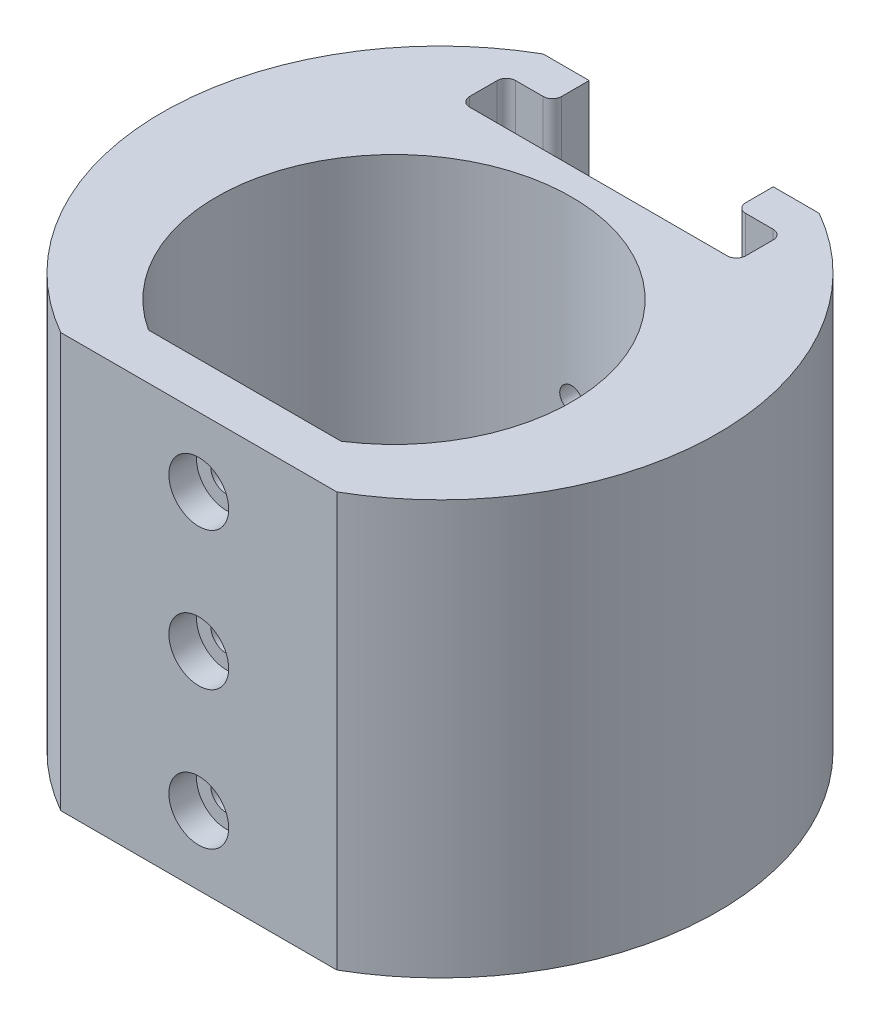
SolidWorks part; units mm, degrees
ref_plane "Front Plane" through (0, 0, 0) normal (0, 0, 1) x (1, 0, 0)
ref_plane "Top Plane" through (0, 0, 0) normal (0, 1, 0) x (1, 0, 0)
ref_plane "Right Plane" through (0, 0, 0) normal (1, 0, 0) x (0, 0, -1)
sketch "Sketch1" plane through (0, 0, 0) normal (0, 1, 0) x (1, 0, 0)
  line L0 (-10, -16.2143) -> (10, -16.2143)
  line L1 (-15, -21.2143) -> (15, -21.2143)
  line L2 (-15, 31.2143) -> (15, 31.2143)
  arc A0 (10, -16.2143) -> (-10, -16.2143) centre (0, 0) ccw
  arc A1 (15, -21.2143) -> (15, 31.2143) centre (0, 5) ccw
  arc A2 (-15, 31.2143) -> (-15, -21.2143) centre (0, 5) ccw
  point P5 (0, -21.2143)
extrude "Boss-Extrude1" add sketch "Sketch1" along normal mid plane 45
sketch "Sketch4" plane through (0, 22.5, 0) normal (0, 1, 0) x (1, 0, 0)
  line L0 (-10, 31.2143) -> (-10, 27.2143)
  line L2 (10, 27.2143) -> (10, 31.2143)
  line L3 (10, 31.2143) -> (-10, 31.2143)
  line L4 (-10, 27.2143) -> (-15, 27.2143)
  line L5 (-15, 27.2143) -> (-15, 22.2143)
  line L6 (-15, 22.2143) -> (15, 22.2143)
  line L7 (15, 22.2143) -> (15, 27.2143)
  line L8 (15, 27.2143) -> (10, 27.2143)
  line L9 (15, 31.2143) -> (-15, 31.2143) construction
  point P11 (0, 22.2143)
  point P12 (0, 31.2143)
  dimension "D1" = 4
  dimension "D2" = 30
  dimension "D3" = 5
  dimension "D4" = 20
extrude "Cut-Extrude1" cut sketch "Sketch4" against normal blind 36
fillet "Fillet1" radius 1 6 edges at (10, 4.5, -27.2143) (15, 4.5, -22.2143) (15, 4.5, -27.2143) (-15, 4.5, -22.2143) (-15, 4.5, -27.2143) (-10, 4.5, -27.2143)
hole_wizard "CBORE for M3 SHCS1" positions "Sketch5" profile "Sketch6" counterbore size "M3" standard "ANSI Metric"
sketch "Sketch5" plane through (0, 0, 21.2143) normal (0, 0, 1) x (1, 0, 0)
  line L0 (0, 0) -> (0, 15) construction
  line L1 (0, 0) -> (0, -15) construction
  point P0 (0, 0)
  point P15 (0, 15)
  point P16 (0, 0)
  point P17 (0, -15)
  dimension "D3" = 15
  dimension "D4" = 15
  dimension "D1" = 2
  dimension "D2" = 2
sketch "Sketch6" plane through (0, 0, 21.2143) normal (1, 0, 0) x (0, -1, 0)
  line L0 (0, 0) -> (0, 6.0215)
  line L1 (0, 6.0215) -> (1.7, 5)
  line L2 (1.7, 5) -> (1.7, 3)
  line L3 (1.7, 3) -> (3.25, 3)
  line L4 (3.25, 3) -> (3.25, 0)
  line L5 (3.25, 0) -> (0, 0)
  line L10 (0, 6.0215) -> (-1.7, 5) construction
  line L11 (0, -6.35) -> (0, 107.95) construction
  dimension "Hole Dia." = 3.4
  dimension "Hole Depth" = 5
  dimension "C'Bore Dia." = 6.5
  dimension "C'Bore Depth" = 3
  dimension "Drill Angle" = 118
hole_wizard "M3x0.5 Tapped Hole1" positions "Sketch7" profile "Sketch8" tap size "M3x0.5" standard "ANSI Metric"
sketch "Sketch7" plane through (0, 0, -22.2143) normal (0, 0, -1) x (-1, 0, 0)
  point P0 (0, 3.5)
  point P3 (0, -6.5)
sketch "Sketch8" plane through (0, 3.5, -22.2143) normal (1, 0, 0) x (0, 1, 0)
  line L0 (0, 0) -> (0, 20.7964)
  line L1 (0, 20.7964) -> (1.25, 20.0453)
  line L2 (1.25, 20.0453) -> (1.25, 0)
  line L3 (1.25, 0) -> (0, 0)
  line L4 (0, 20.7964) -> (-1.25, 20.0453) construction
  line L5 (0, -6.35) -> (0, 107.95) construction
  dimension "Tap Drill Dia." = 2.5
  dimension "Tap Drill Depth" = 20.7964
  dimension "Drill Angle" = 118
other "Tolerancing" parameters "D1"=0.25
equation "\"shaftDia\" = 38.1"
equation "\"D1@Sketch1\"=\"shaftDia\""
